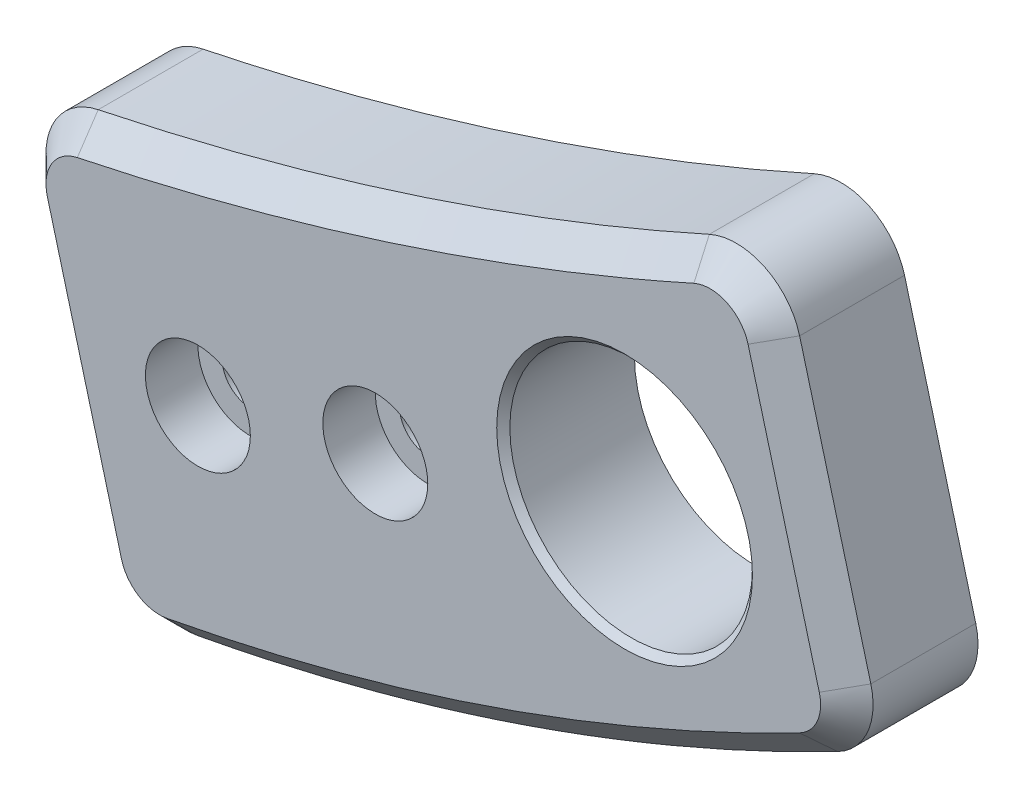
SolidWorks part; units mm, degrees
ref_plane "Plan de face" through (0, 0, 0) normal (0, 0, 1) x (1, 0, 0)
ref_plane "Plan de dessus" through (0, 0, 0) normal (0, 1, 0) x (1, 0, 0)
ref_plane "Plan de droite" through (0, 0, 0) normal (1, 0, 0) x (0, 0, -1)
sketch "Esquisse1" plane through (0, 0, 0) normal (0, 0, 1) x (1, 0, 0)
  line L0 (-0.7395, 9.26) -> (-0.7395, 0)
  line L1 (-0.7395, 0) -> (-8.7395, 0)
  line L2 (-11.212, -0.3463) -> (-15.725, -1.6357)
  line L3 (-0.7395, 13.66) -> (-19.6827, 8.2476)
  line L4 (89.2605, -120.251) -> (-60.7622, -160.4495) construction
  line L5 (89.2605, -120.251) -> (-87.485, -120.251) construction
  line L6 (-86.1521, -200) -> (170.4283, -200) construction
  line L7 (89.2605, -183.0726) -> (89.2605, -200) construction
  line L8 (-0.7395, 13.66) -> (38.0779, 22.1236)
  line L9 (-0.7395, 13.66) -> (-0.7395, 74.26) construction
  line L10 (89.2605, -200) -> (89.2605, -216.9274) construction
  line L11 (101.2572, -177.7054) -> (109.2605, -207.5742)
  arc A2 (-8.7395, 0) -> (-11.212, -0.3463) centre (-8.7395, -9) ccw
  arc A8 (-0.7395, 9.26) -> (38.0779, 22.1236) centre (-0.7395, 74.26) ccw
  ellipse E0 centre (-14.2395, -121.4237) end of major axis (-14.2395, -1.4237) minor radius 25 (-15.725, -1.6357) -> (-34.1467, -194.014) ccw
  ellipse E1 centre (-14.2395, -121.4237) end of major axis (-14.2395, 9.0229) minor radius 50 (-19.6827, 8.2476) -> (-52.4262, -205.6311) ccw
  ellipse E3 centre (45.7938, -131.8979) end of major axis (-80.047, -165.6168) minor radius 94.5 (-52.4262, -205.6311) -> (109.2605, -207.5742) ccw
  ellipse E4 centre (45.7938, -131.8979) end of major axis (-70.1173, -162.9562) minor radius 62.5 (-34.1467, -194.014) -> (101.2572, -177.7054) ccw
  point P15 (-10, 0)
  dimension "D3" = 240
  dimension "D9" = 65
  dimension "D10" = 60.6
  dimension "D13" = 13.5
  dimension "D14" = 15
  dimension "D15" = 125
  dimension "D16" = 9
  dimension "D19" = 200
  dimension "D18" = 260.56
  dimension "D4" = 90
  dimension "D5" = 32
  dimension "D6" = 13.66
  dimension "D7" = 8
  dimension "D8" = 102.3
  dimension "D11" = 50
  dimension "D12" = 25
  dimension "D17" = 240
  dimension "D20" = 45
  dimension "D21" = 20
extrude "Boss.-Extru.1" add sketch "Esquisse1" along normal blind 4
fillet "Congé1" radius 3.2 1 edges at (-0.7395, 9.26, 2)
fillet "Congé2" radius 0.8 1 edges at (38.0779, 22.1236, 2)
sketch "Esquisse6" plane through (0, 0, 4) normal (0, 0, 1) x (1, 0, 0)
  line L0 (34.166, 21.2706) -> (-0.7395, 13.66) construction
  circle A0 centre (13.8526, 13.8888) radius 1.5
  arc A1 (34.7735, 19.8189) -> (34.166, 21.2706) centre (34.3364, 20.489) ccw construction
  dimension "D1" = 3
  dimension "D3" = 21.5209
  dimension "D2" = 2.8851
extrude "Enlèv. mat.-Extru.2" cut sketch "Esquisse6" against normal blind 4
fillet "Congé4" radius 40 1 edges at (-34.1467, -194.014, 2)
fillet "Congé5" radius 55 1 edges at (-52.4262, -205.6311, 2)
fillet "Congé6" radius 5 2 edges at (109.2605, -207.5742, 2) (101.2572, -177.7054, 2)
sketch "Esquisse7" plane through (0, 0, 4) normal (0, 0, 1) x (1, 0, 0)
  line L0 (108.2328, -203.7388) -> (102.802, -183.4706) construction
  line L1 (108.2328, -203.7388) -> (102.802, -183.4706)
  line L2 (44.1218, -196.2953) -> (52.3508, -227.0064)
  arc A0 (102.802, -183.4706) -> (95.9166, -180.2069) centre (97.9723, -184.7647) ccw construction
  arc A1 (102.802, -183.4706) -> (95.9166, -180.2069) centre (97.9723, -184.7647) ccw
  arc A2 (105.7042, -209.472) -> (108.2328, -203.7388) centre (103.4032, -205.0329) ccw construction
  arc A3 (105.7042, -209.472) -> (108.2328, -203.7388) centre (103.4032, -205.0329) ccw
  ellipse E2 centre (45.7938, -131.8979) end of major axis (-80.047, -165.6168) minor radius 94.5 (-23.5509, -221.1552) -> (105.7042, -209.472) ccw construction
  ellipse E3 centre (45.7938, -131.8979) end of major axis (161.7049, -100.8396) minor radius 62.5 (0.6872, -199.6701) -> (95.9166, -180.2069) ccw construction
  ellipse E4 centre (45.7938, -131.8979) end of major axis (-80.047, -165.6168) minor radius 94.5 (52.3508, -227.0064) -> (105.7042, -209.472) ccw
  ellipse E5 centre (45.7938, -131.8979) end of major axis (-70.1173, -162.9562) minor radius 62.5 (44.1218, -196.2953) -> (95.9166, -180.2069) ccw
  dimension "D1" = 60
extrude "Enlèv. mat.-Extru.3" cut sketch "Esquisse7" against normal through all flip side to cut
fillet "Congé7" radius 5 2 edges
sketch "Esquisse8" plane through (0, 0, 4) normal (0, 0, 1) x (1, 0, 0)
  line L2 (45.5074, -201.4667) -> (51.1676, -222.5907)
  line L3 (108.2328, -203.7388) -> (102.802, -183.4706)
  line L4 (45.5074, -201.4667) -> (51.1676, -222.5907)
  line L5 (108.2328, -203.7388) -> (102.802, -183.4706)
  arc A4 (51.1676, -222.5907) -> (56.9192, -226.2109) centre (55.9972, -221.2966) ccw
  arc A5 (105.7042, -209.472) -> (108.2328, -203.7388) centre (103.4032, -205.0329) ccw
  arc A6 (102.802, -183.4706) -> (95.9166, -180.2069) centre (97.9723, -184.7647) ccw
  arc A7 (49.3187, -195.2774) -> (45.5074, -201.4667) centre (50.3371, -200.1726) ccw
  arc A8 (51.1676, -222.5907) -> (56.9192, -226.2109) centre (55.9972, -221.2966) ccw
  arc A9 (105.7042, -209.472) -> (108.2328, -203.7388) centre (103.4032, -205.0329) ccw
  arc A10 (102.802, -183.4706) -> (95.9166, -180.2069) centre (97.9723, -184.7647) ccw
  arc A11 (49.3187, -195.2774) -> (45.5074, -201.4667) centre (50.3371, -200.1726) ccw
  ellipse E2 centre (45.7938, -131.8979) end of major axis (-80.047, -165.6168) minor radius 94.5 (56.9192, -226.2109) -> (105.7042, -209.472) ccw
  ellipse E3 centre (45.7938, -131.8979) end of major axis (161.7049, -100.8396) minor radius 62.5 (49.3187, -195.2774) -> (95.9166, -180.2069) ccw
  ellipse E4 centre (45.7938, -131.8979) end of major axis (-80.047, -165.6168) minor radius 94.5 (56.9192, -226.2109) -> (105.7042, -209.472) ccw
  ellipse E5 centre (45.7938, -131.8979) end of major axis (-70.1173, -162.9562) minor radius 62.5 (49.3187, -195.2774) -> (95.9166, -180.2069) ccw
  dimension "D1" = 0
extrude "Boss.-Extru.2" add sketch "Esquisse8" along normal blind 6
chamfer "Chanfrein1" distance 2 angle 45 8 edges at (73.1983, -188.9511, 10) (100.114, -180.2466, 10) (105.5174, -193.6047, 10) (107.978, -207.0507, 10) (82.0318, -219.5839, 10) (53.3338, -225.5282, 10) (48.3375, -212.0287, 10) (46.0795, -197.5509, 10)
hole_wizard "Diamètre du perçage Ø18.5 (18.5)1" positions "Esquisse10" profile "Esquisse9" hole size "Ø18.5" standard "ISO"
sketch "Esquisse10" plane through (0, 0, 10) normal (0, 0, 1) x (1, 0, 0)
  line L0 (87.3712, -183.8379) -> (95.5396, -214.3227) construction
  line L1 (102.802, -183.4706) -> (108.2328, -203.7388) construction
  ellipse E0 centre (45.7938, -131.8979) end of major axis (161.7049, -100.8396) minor radius 62.5 (49.3187, -195.2774) -> (95.9166, -180.2069) ccw construction
  ellipse E1 centre (45.7938, -131.8979) end of major axis (-80.047, -165.6168) minor radius 94.5 (56.9192, -226.2109) -> (105.7042, -209.472) ccw construction
  point P0 (91.4554, -199.0803)
  dimension "D1" = 15
sketch "Esquisse9" plane through (91.4554, -199.0803, 10) normal (1, 0, 0) x (0, -1, 0)
  line L0 (0, 0) -> (0, 65.558)
  line L1 (0, 65.558) -> (9.25, 60)
  line L2 (9.25, 60) -> (9.25, 0)
  line L5 (9.25, 0) -> (0, 0)
  line L10 (0, 65.558) -> (-9.25, 60) construction
  line L11 (0, -6.35) -> (0, 107.95) construction
  dimension "Diamètre du perçage" = 18.5
  dimension "Profondeur du perçage" = 60
  dimension "Angle de pointe" = 118
chamfer "Chanfrein2" distance 0.5 angle 45 1 edges at (100.7054, -199.0803, 10)
hole_wizard "Chambrage pour vis à tête cylindrique à 6 pans creux (ou vis CHC) M41" positions "Esquisse12" profile "Esquisse11" counterbore size "M4" standard "Ansi Métrique"
sketch "Esquisse12" plane through (0, 0, 10) normal (0, 0, 1) x (1, 0, 0)
  line L0 (47.4393, -200.949) -> (53.0994, -222.0731) construction
  spline S0 degree 3 poles (-665.9308, 2598.18) (1583.9801, -978.529) (-741.4308, -1195.4117) (-1487.2974, 2231.0702) knots -21.326854 -21.326854 -21.326854 -21.326854 23.544076 23.544076 23.544076 23.544076 only from (102.2764, -194.3421) to (52.4887, -210.4498)
  spline S1 degree 3 poles (102.2764, -194.3421) (86.4773, -201.448) (69.8587, -206.8183) (52.4887, -210.4498) knots 0 0 0 0 1 1 1 1 construction
  point P0 (72.4467, -205.413)
  point P1 (58.9188, -209.0179)
  dimension "D2" = 14
  dimension "D3" = 9
  dimension "D1" = 13.5
sketch "Esquisse11" plane through (72.4467, -205.413, 10) normal (1, 0, 0) x (0, -1, 0)
  line L0 (0, 0) -> (0, 10)
  line L1 (0, 10) -> (2.15, 10)
  line L3 (2.15, 10) -> (2.15, 4)
  line L4 (2.15, 4) -> (4, 4)
  line L5 (4, 4) -> (4, 0)
  line L7 (4, 0) -> (0, 0)
  line L11 (0, -6.35) -> (0, 107.95) construction
  dimension "Diamètre du perçage jusqu'au prochain" = 4.3
  dimension "Profondeur du perçage jusqu'au prochain" = 10
  dimension "Diamètre du chambrage" = 8
  dimension "Profondeur du chambrage" = 4
